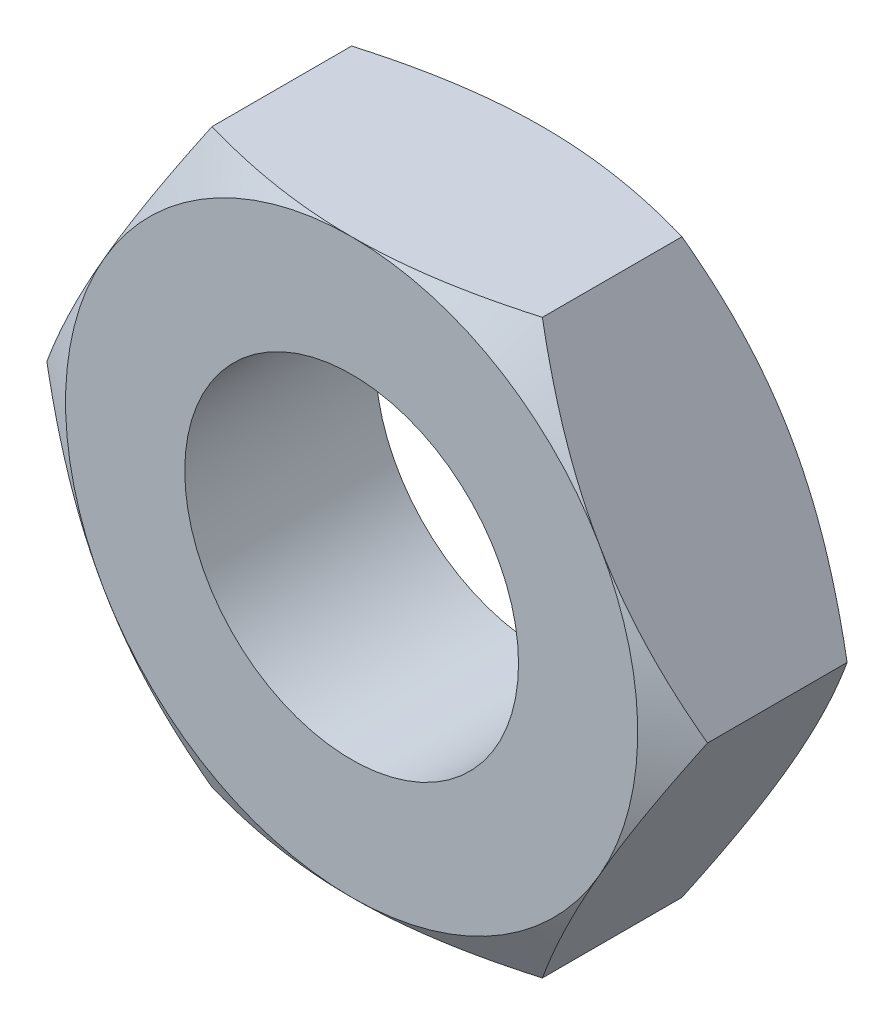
SolidWorks part; units mm, degrees
ref_plane "Front Plane" through (0, 0, 0) normal (0, 0, 1) x (1, 0, 0)
ref_plane "Top Plane" through (0, 0, 0) normal (0, 1, 0) x (1, 0, 0)
ref_plane "Right Plane" through (0, 0, 0) normal (1, 0, 0) x (0, 0, -1)
sketch "Sketch1" plane through (0, 0, 0) normal (0, 0, 1) x (1, 0, 0)
  line L1 (6.9282, -12) -> (13.8564, 0)
  line L2 (13.8564, 0) -> (6.9282, 12)
  line L3 (6.9282, 12) -> (-6.9282, 12)
  line L4 (-6.9282, 12) -> (-13.8564, 0)
  line L5 (-13.8564, 0) -> (-6.9282, -12)
  line L6 (-6.9282, -12) -> (6.9282, -12)
  circle A0 centre (0, 0) radius 12 construction
  dimension "D1" = 24
extrude "Extrude1" add sketch "Sketch1" along normal blind 8
hole_wizard " Tapped Hole1" positions "Sketch3" profile "Sketch2" tap size "M16" standard "DIN"
sketch "Sketch3" plane through (0, 0, 8) normal (0, 0, 1) x (1, 0, 0)
  point P0 (0, 0)
sketch "Sketch2" plane through (0, 0, 8) normal (1, 0, 0) x (0, -1, 0)
  line L0 (0, 0) -> (0, 8)
  line L1 (0, 8) -> (7, 8)
  line L2 (7, 8) -> (7, 0)
  line L5 (7, 0) -> (0, 0)
  line L11 (0, -6.35) -> (0, 107.95) construction
  dimension "Thru Tap Drill Dia." = 14
  dimension "Thru Tap Drill Depth" = 8
sketch "Sketch4" plane through (0, 0, 0) normal (0, 1, 0) x (1, 0, 0)
  line L0 (-13.8564, -6.9282) -> (-12, -8)
  line L1 (-13.8564, -8) -> (-13.8564, 0) construction
  line L2 (-6.9282, -8) -> (-13.8564, -8) construction
  line L3 (-13.8564, -8) -> (-13.8564, -6.9282)
  line L4 (-12, -8) -> (-13.8564, -8)
  line L5 (-13.8564, -4) -> (13.8564, -4) construction
  line L6 (13.8564, -8) -> (13.8564, 0) construction
  line L7 (-13.8564, -1.0718) -> (-12, 0)
  line L8 (-13.8564, 0) -> (-13.8564, -1.0718)
  line L9 (-12, 0) -> (-13.8564, 0)
  line L10 (0, 0) -> (0, -8) construction
  line L11 (6.9282, -8) -> (-6.9282, -8) construction
  dimension "D1" = 30
  dimension "D2" = 12
revolve "Cut-Revolve1" cut sketch "Sketch4" angle 360 about L10
